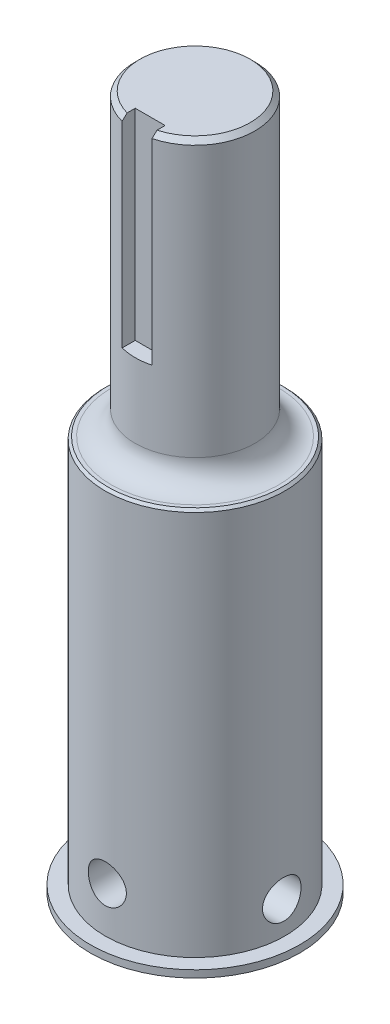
SolidWorks part; units mm, degrees
ref_plane "Front Plane" through (0, 0, 0) normal (0, 0, 1) x (1, 0, 0)
ref_plane "Top Plane" through (0, 0, 0) normal (0, 1, 0) x (1, 0, 0)
ref_plane "Right Plane" through (0, 0, 0) normal (1, 0, 0) x (0, 0, -1)
sketch "Sketch1" plane through (0, 0, 0) normal (0, 1, 0) x (1, 0, 0)
  circle A0 centre (0, 0) radius 11.1125
  dimension "D1" = 22.225
extrude "Extrude1" add sketch "Sketch1" along normal blind 41.91
sketch "Sketch2" plane through (0, 0, 0) normal (0, -1, 0) x (1, 0, 0)
  circle A0 centre (0, 0) radius 6.0008
  dimension "D1" = 12.0015
extrude "Cut-Extrude1" cut sketch "Sketch2" against normal blind 25.4
ref_plane "Plane3" through (0, 0.762, 0) normal (0, -1, 0) x (1, 0, 0)
chamfer "Chamfer1" distance 0.254 angle 45 1 edges at (0, 0, -6.0008)
sketch "Sketch10" plane through (0, 0.762, 0) normal (0, -1, 0) x (1, 0, 0)
  circle A0 centre (0, 0) radius 9.525
  circle A1 centre (0, 0) radius 11.6852
  dimension "D1" = 19.05
extrude "Cut-Extrude2" cut sketch "Sketch10" against normal through all
sketch "Sketch3" plane through (0, 41.91, 0) normal (0, 1, 0) x (-1, 0, 0)
  circle A0 centre (0, 0) radius 6.35
extrude "Extrude2" add sketch "Sketch3" along normal blind 31.75
fillet "Fillet1" radius 2.54 1 edges at (0, 41.91, 6.35)
chamfer "Chamfer2" distance 0.254 angle 45 1 edges at (0, 41.91, -9.525)
chamfer "Chamfer3" distance 0.508 angle 45 1 edges at (0, 73.66, 6.35)
ref_plane "Plane1" through (9.525, 0, 0) normal (1, 0, 0) x (0, 0, -1)
hole_wizard "#10-32 Tapped Hole1" positions "3DSketch2" profile "Sketch6" tap size "#10-32" standard "Ansi Inch"
sketch3d "3DSketch2"
  circle A0 centre (0, 0, 0) radius 11.1125 construction
  point P0 (11.1117, 4.2059, 0.1303)
  point P5 (0, 11.1125, 0)
  dimension "D1" = 11.8818
sketch "Sketch6" plane through (11.1117, 4.2059, 0.1303) normal (0, 1, 0) x (0.0117, 0, -0.9999)
  line L0 (0, 0) -> (0, 5.1117)
  line L1 (0, 5.1117) -> (2.0193, 5.1117)
  line L2 (2.0193, 5.1117) -> (2.0193, 0)
  line L5 (2.0193, 0) -> (0, 0)
  line L11 (0, -6.35) -> (0, 107.95) construction
  dimension "Thru Tap Drill Dia." = 4.0386
  dimension "Thru Tap Drill Depth" = 5.1117
ref_plane "Plane2" through (0, 0, 9.525) normal (0, 0, 1) x (1, 0, 0)
hole_wizard "#10-32 Tapped Hole2" positions "Sketch8" profile "Sketch9" tap size "#10-32" standard "Ansi Inch"
sketch "Sketch8" plane through (0, 0, 9.525) normal (0, 0, 1) x (1, 0, 0)
  line L2 (-11.1125, 0) -> (11.1125, 0) construction
  point P0 (0, 5.588)
  dimension "D1" = 5.588
sketch "Sketch9" plane through (0, 5.588, 9.525) normal (1, 0, 0) x (0, -1, 0)
  line L0 (0, 0) -> (0, 9.525)
  line L1 (0, 9.525) -> (2.0193, 9.525)
  line L2 (2.0193, 9.525) -> (2.0193, 0)
  line L5 (2.0193, 0) -> (0, 0)
  line L11 (0, -6.35) -> (0, 107.95) construction
  dimension "Thru Tap Drill Dia." = 4.0386
  dimension "Thru Tap Drill Depth" = 9.525
ref_plane "Plane4" through (0, 0, 4.7625) normal (0, 0, 1) x (1, 0, 0)
sketch "Sketch11" plane through (0, 0, 4.7625) normal (0, 0, 1) x (1, 0, 0)
  line L0 (5.842, 73.66) -> (-5.842, 73.66) construction
  line L1 (-1.5875, 73.66) -> (1.5875, 73.66)
  line L2 (-1.5875, 73.66) -> (-1.5875, 52.324)
  line L3 (-1.5875, 52.324) -> (1.5875, 52.324)
  line L4 (1.5875, 73.66) -> (1.5875, 52.324)
  dimension "D1" = 3.175
  dimension "D2" = 1.5875
  dimension "D3" = 21.336
extrude "Cut-Extrude3" cut sketch "Sketch11" along normal through all
